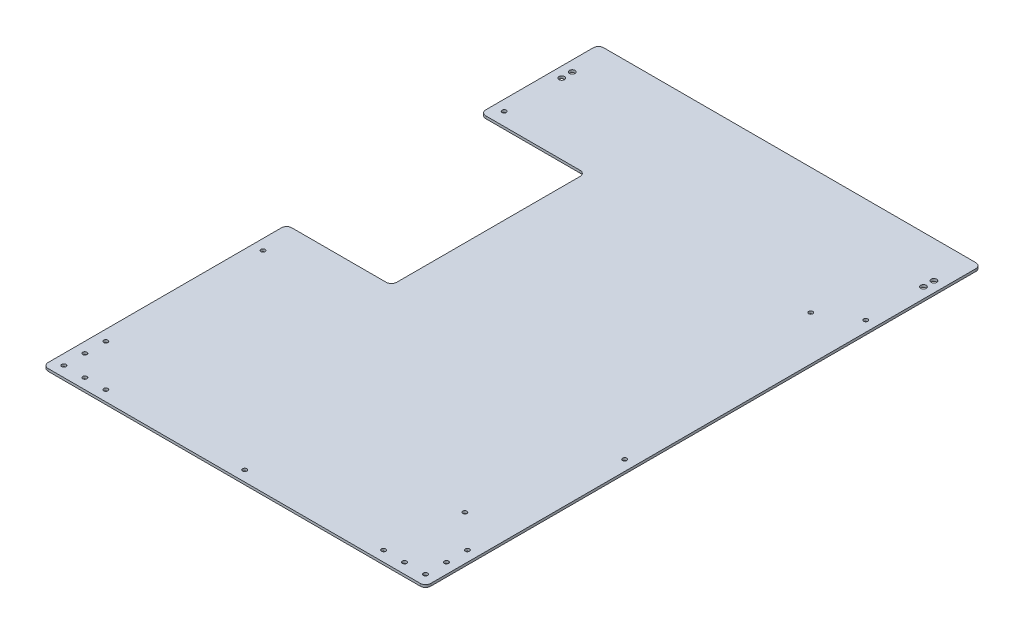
SolidWorks part; units mm, degrees
ref_plane "Front Plane" through (0, 0, 0) normal (0, 0, 1) x (1, 0, 0)
ref_plane "Top Plane" through (0, 0, 0) normal (0, 1, 0) x (1, 0, 0)
ref_plane "Right Plane" through (0, 0, 0) normal (1, 0, 0) x (0, 0, -1)
sketch "Sketch1" plane through (0, 0, 0) normal (0, 1, 0) x (1, 0, 0)
  line L0 (-231.775, 193.675) -> (-104.775, 193.675)
  line L1 (-231.775, 336.55) -> (231.775, 336.55)
  line L2 (-231.775, 336.55) -> (-231.775, -336.55)
  line L3 (-231.775, -336.55) -> (231.775, -336.55)
  line L4 (231.775, 336.55) -> (231.775, -336.55)
  line L5 (-231.775, 336.55) -> (231.775, -336.55) construction
  line L6 (-231.775, -336.55) -> (231.775, 336.55) construction
  line L7 (-104.775, 193.675) -> (-104.775, -41.275)
  line L8 (-104.775, -41.275) -> (-231.775, -41.275)
  point P0 (0, 0)
  dimension "D1" = 463.55
  dimension "D2" = 673.1
  dimension "D3" = 127
  dimension "D4" = 234.95
  dimension "D5" = 295.275
extrude "Boss-Extrude1" add sketch "Sketch1" along normal blind 2.9972 contours L7 L8 L2 L3 L4 L1 L0
fillet "Fillet1" radius 6.35 8 edges at (-104.775, 1.4986, 41.275) (-104.775, 1.4986, -193.675) (231.775, 1.4986, -336.55) (231.775, 1.4986, 336.55) (-231.775, 1.4986, 336.55) (-231.775, 1.4986, 41.275) (-231.775, 1.4986, -193.675) (-231.775, 1.4986, -336.55)
hole_wizard "#7 (0.201) Diameter Hole1" positions "Sketch2" profile "Sketch3" hole size "#7" standard "ANSI Inch"
sketch "Sketch2" plane through (0, 2.9972, 0) normal (0, 1, 0) x (1, 0, 0)
  line L0 (-225.425, 336.55) -> (225.425, 336.55) construction
  line L1 (231.775, 330.2) -> (231.775, -330.2) construction
  point P0 (177.8, 184.15)
  point P2 (177.8, -234.95)
  dimension "D1" = 152.4
  dimension "D2" = 419.1
  dimension "D3" = 53.975
sketch "Sketch3" plane through (177.8, 2.9972, -184.15) normal (1, 0, 0) x (0, 0, 1)
  line L0 (0, 0) -> (0, 2.9972)
  line L1 (0, 2.9972) -> (2.5527, 2.9972)
  line L2 (2.5527, 2.9972) -> (2.5527, 0)
  line L5 (2.5527, 0) -> (0, 0)
  line L11 (0, -6.35) -> (0, 107.95) construction
  dimension "Thru Hole Dia." = 5.1054
  dimension "Thru Hole Depth" = 2.9972
hole_wizard "#7 (0.201) Diameter Hole2" positions "Sketch4" profile "Sketch5" hole size "#7" standard "ANSI Inch"
sketch "Sketch4" plane through (0, 2.9972, 0) normal (0, 1, 0) x (1, 0, 0)
  line L0 (-225.425, -336.55) -> (225.425, -336.55) construction
  line L1 (231.775, 330.2) -> (231.775, -330.2) construction
  line L2 (-231.775, -41.275) -> (-231.775, -336.55) construction
  line L3 (-225.425, 336.55) -> (225.425, 336.55) construction
  line L4 (-231.775, -47.625) -> (-231.775, -330.2) construction
  point P0 (-219.075, -323.85)
  point P2 (-219.075, -298.45)
  point P4 (-219.075, -273.05)
  point P6 (-193.675, -323.85)
  point P8 (-168.275, -323.85)
  point P10 (168.275, -323.85)
  point P12 (193.675, -323.85)
  point P14 (219.075, -323.85)
  point P16 (219.075, -298.45)
  point P18 (219.075, -273.05)
  point P27 (-219.075, -82.55)
  point P29 (-219.075, 209.55)
  point P31 (219.075, 209.55)
  point P33 (219.075, -82.55)
  point P38 (0, -323.85)
  point P43 (0, 0)
  dimension "D1" = 12.7
  dimension "D2" = 12.7
  dimension "D3" = 25.4
  dimension "D4" = 25.4
  dimension "D5" = 25.4
  dimension "D6" = 25.4
  dimension "D7" = 12.7
  dimension "D8" = 25.4
  dimension "D9" = 25.4
  dimension "D10" = 190.5
  dimension "D11" = 127
  dimension "D12" = 231.775
sketch "Sketch5" plane through (-219.075, 2.9972, 323.85) normal (1, 0, 0) x (0, 0, 1)
  line L0 (0, 0) -> (0, 2.9972)
  line L1 (0, 2.9972) -> (2.5527, 2.9972)
  line L2 (2.5527, 2.9972) -> (2.5527, 0)
  line L5 (2.5527, 0) -> (0, 0)
  line L11 (0, -6.35) -> (0, 107.95) construction
  dimension "Thru Hole Dia." = 5.1054
  dimension "Thru Hole Depth" = 2.9972
hole_wizard "17/64 (0.26563) Diameter Hole1" positions "Sketch6" profile "Sketch7" hole size "17/64" standard "ANSI Inch"
sketch "Sketch6" plane through (0, 2.9972, 0) normal (0, 1, 0) x (1, 0, 0)
  line L0 (-225.425, 336.55) -> (225.425, 336.55) construction
  line L1 (231.775, 330.2) -> (231.775, -330.2) construction
  line L2 (-231.775, 336.55) -> (-231.775, 193.675) construction
  point P0 (219.075, 279.4)
  point P2 (219.075, 292.1)
  point P10 (-219.075, 279.4)
  point P12 (-219.075, 292.1)
  point P17 (203.6534, 260.35)
  point P18 (0, 0)
  point P19 (-202.1213, 260.35)
  point P20 (-214.9261, 242.1411)
  point P21 (-213.6712, 243.8823)
  point P22 (0, 0)
  point P23 (0, 0)
  point P24 (0, 0)
  dimension "D1" = 12.7
  dimension "D2" = 44.45
  dimension "D3" = 12.7
  dimension "D5" = 12.7
sketch "Sketch7" plane through (219.075, 2.9972, -279.4) normal (1, 0, 0) x (0, 0, 1)
  line L0 (0, 0) -> (0, 2.9972)
  line L1 (0, 2.9972) -> (3.3735, 2.9972)
  line L2 (3.3735, 2.9972) -> (3.3735, 0)
  line L5 (3.3735, 0) -> (0, 0)
  line L11 (0, -6.35) -> (0, 107.95) construction
  dimension "Thru Hole Dia." = 6.747
  dimension "Thru Hole Depth" = 2.9972
